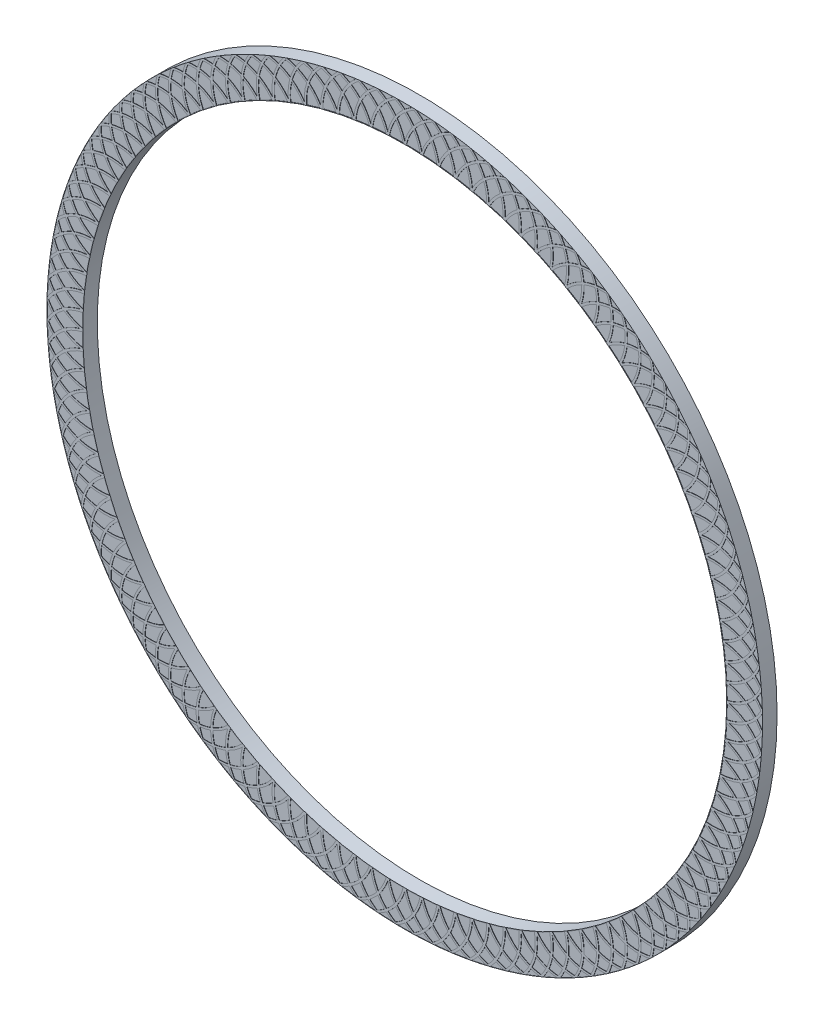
SolidWorks part; units mm, degrees
ref_plane "Ebene vorne" through (0, 0, 0) normal (0, 0, 1) x (1, 0, 0)
ref_plane "Ebene oben" through (0, 0, 0) normal (0, 1, 0) x (1, 0, 0)
ref_plane "Ebene rechts" through (0, 0, 0) normal (1, 0, 0) x (0, 0, -1)
sketch "Skizze1" plane through (0, 0, 0) normal (0, 0, 1) x (1, 0, 0)
  circle A0 centre (0, 0) radius 225
  circle A1 centre (0, 0) radius 250
  dimension "D1" = 500
  dimension "D2" = 450
extrude "Aufsatz-Linear austragen1" add sketch "Skizze1" along normal blind 10
sketch "Skizze2" plane through (0, 0, 10) normal (0, 0, 1) x (1, 0, 0)
  circle A1 centre (0, 0) radius 250
  circle A2 centre (0, 0) radius 250 construction
extrude "Linear-Austragen-Dünn1" add sketch "Skizze2" along normal blind 0.2 thin
sketch "Skizze3" plane through (0, 0, 10) normal (0, 0, 1) x (1, 0, 0)
  circle A1 centre (0, 0) radius 225
  circle A2 centre (0, 0) radius 225 construction
extrude "Linear-Austragen-Dünn2" add sketch "Skizze3" along normal blind 0.2 thin
sketch "Skizze4" plane through (0, 0, 10.2) normal (0, 0, 1) x (1, 0, 0)
  arc A0 (-19.3755, 249.1478) -> (-34.9122, 222.4774) centre (0, 220) ccw
  circle A1 centre (0, 0) radius 225.2 construction
  circle A5 centre (0, 0) radius 249.9 construction
  circle A6 centre (0, 0) radius 225.2 construction
  dimension "D1" = 220
  dimension "D2" = 35
rib "Verstärkungsrippe1" sketch "Skizze4" sketch "Skizze4" thickness 1.5 extrusion direction normal to sketch draft on no parameters "D1"=1.5
mirror "Spiegeln1" about plane through (0, 0, 0) normal (1, 0, 0) of "Verstärkungsrippe1"
pattern_circular "Kreismuster1" count 120 over 360 about axis through (0, 0, 0) along (0, 0, 1) of "Spiegeln1", "Verstärkungsrippe1"
